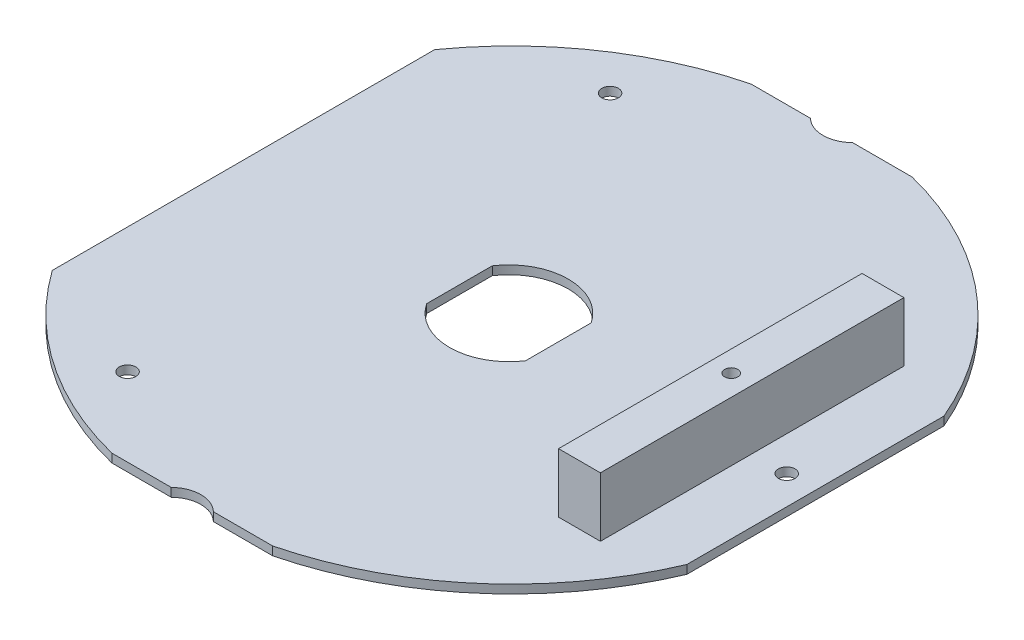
SolidWorks part; units mm, degrees
ref_plane "Front Plane" through (0, 0, 0) normal (0, 0, 1) x (1, 0, 0)
ref_plane "Top Plane" through (0, 0, 0) normal (0, 1, 0) x (1, 0, 0)
ref_plane "Right Plane" through (0, 0, 0) normal (1, 0, 0) x (0, 0, -1)
sketch "Sketch1" plane through (0, 0, 0) normal (0, 1, 0) x (1, 0, 0)
  line L0 (-51.7281, 36.83) -> (-51.7281, 0)
  line L1 (58.4717, 24.765) -> (58.4717, 0)
  line L2 (0, 0) -> (-51.7281, 0) construction
  line L3 (58.4717, 0) -> (0, 0) construction
  line L4 (-27.5746, -46.482) -> (-26.1888, -45.6819) construction
  line L5 (-26.1888, -45.6819) -> (51.5487, -0.8001) construction
  line L6 (51.5487, -0.8001) -> (52.9345, 0) construction
  line L7 (-27.5746, -44.8818) -> (-27.5746, 0) construction
  line L8 (-27.5746, 0) -> (-27.5746, 44.8818) construction
  line L9 (-27.5746, 44.8818) -> (-27.5746, 46.482) construction
  line L10 (-27.5746, 46.482) -> (-26.1888, 45.6819) construction
  line L11 (-26.1888, 45.6819) -> (51.5487, 0.8001) construction
  line L12 (51.5487, 0.8001) -> (52.9345, 0) construction
  line L13 (-27.5746, -44.8818) -> (-27.5746, -46.482) construction
  line L14 (0, 59.9297) -> (0, 65.7571) construction
  line L15 (-51.7281, 0) -> (-51.7281, -36.83)
  line L16 (0, 0) -> (0, 63.5) construction
  line L17 (-4.064, 61.5807) -> (-15.494, 61.5807)
  line L18 (58.4717, 0) -> (58.4717, -24.765)
  line L19 (8.9417, 6.3182) -> (8.9417, -6.3182)
  line L20 (15.494, 61.5807) -> (4.064, 61.5807)
  line L21 (15.494, -61.5807) -> (4.064, -61.5807)
  line L22 (0, -63.5) -> (0, -61.5807) construction
  line L23 (0, 59.9297) -> (0, 63.5) construction
  line L24 (0, -61.5807) -> (0, -59.9297) construction
  line L25 (-4.064, -61.5807) -> (-15.494, -61.5807)
  line L26 (4.064, -61.5807) -> (0, -61.5807) construction
  line L27 (0, -61.5807) -> (-4.064, -61.5807) construction
  line L28 (0, -65.7571) -> (0, -63.5) construction
  line L29 (-10.1083, -6.3182) -> (-10.1083, 6.3182)
  line L30 (-0.5833, 0) -> (-0.5833, -11.43) construction
  line L31 (-10.1083, -6.3182) -> (-0.5833, -6.3182) construction
  line L32 (-0.5833, -6.3182) -> (8.9417, -6.3182) construction
  arc A0 (-51.7281, -36.83) -> (-15.494, -61.5807) centre (0, 0) ccw
  arc A1 (58.4717, 24.765) -> (15.494, 61.5807) centre (0, 0) ccw
  circle A2 centre (-27.5746, -46.482) radius 1.6002
  circle A3 centre (-27.5746, 46.482) radius 1.6002
  circle A4 centre (52.9345, 0) radius 1.6002
  arc A5 (-4.064, 61.5807) -> (4.064, 61.5807) centre (0, 65.7571) ccw
  arc A6 (-10.1083, -6.3182) -> (8.9417, -6.3182) centre (-0.5833, 0) ccw
  arc A7 (-15.494, 61.5807) -> (-51.7281, 36.83) centre (0, 0) ccw
  arc A8 (15.494, -61.5807) -> (58.4717, -24.765) centre (0, 0) ccw
  arc A9 (4.064, -61.5807) -> (-4.064, -61.5807) centre (0, -65.7571) ccw
  arc A10 (8.9417, 6.3182) -> (-10.1083, 6.3182) centre (-0.5833, 0) ccw
  point P14 (-27.5746, 44.8818)
  point P15 (-27.5746, -44.8818)
  point P16 (54.5347, 0)
  point P26 (0, 59.9297)
  point P27 (-4.064, 61.5807)
  point P28 (4.064, 61.5807)
  point P34 (58.4717, 0)
  point P41 (-15.494, -61.5807)
  point P42 (15.494, -61.5807)
  point P43 (15.494, 61.5807)
  point P44 (-15.494, 61.5807)
  point P50 (-4.064, -61.5807)
  point P51 (4.064, -61.5807)
  dimension "D1" = 127
  dimension "D5" = 3.2004
  dimension "D10" = 22.86
  dimension "D2" = 49.53
  dimension "D3" = 73.66
  dimension "D4" = 92.964
  dimension "D6" = 3.937
  dimension "D7" = 92.964
  dimension "D8" = 1.651
  dimension "D9" = 8.128
  dimension "D11" = 19.05
  dimension "D12" = 30.988
  dimension "D13" = 30.988
  dimension "D14" = 1.9193
  dimension "D15" = 8.128
  dimension "D16" = 1.651
  dimension "D17" = 49.53
extrude "Boss-Extrude2" add sketch "Sketch1" along normal blind 1.651 contours A8 L18 L1 A1 L20 A5 L17 A7 L0 L15 A0 L25 A9 L21
sketch "Sketch2" plane through (0, 1.651, 0) normal (0, 1, 0) x (1, 0, 0)
  line L0 (58.4717, -24.765) -> (58.4717, 24.765) construction
  line L1 (38.2152, 29.2354) -> (46.2797, 29.2354)
  line L2 (38.2152, 29.2354) -> (38.2152, -29.2354)
  line L3 (38.2152, -29.2354) -> (46.2797, -29.2354)
  line L4 (46.2797, 29.2354) -> (46.2797, -29.2354)
  line L5 (52.9345, 0) -> (46.2797, 0) construction
  dimension "D1" = 58.4708
  dimension "D2" = 8.0645
  dimension "D3" = 12.192
extrude "Boss-Extrude3" add sketch "Sketch2" along normal blind 11.43 contours L2 L3 L4 L1
sketch "Sketch3" plane through (0, 13.081, 0) normal (0, 1, 0) x (1, 0, 0)
  line L0 (38.2152, 0) -> (42.2475, 0) construction
  line L1 (38.2152, 29.2354) -> (38.2152, -29.2354) construction
  line L2 (42.2475, 0) -> (42.2475, 29.2354) construction
  line L3 (46.2797, 29.2354) -> (38.2152, 29.2354) construction
  circle A0 centre (42.2475, 0) radius 1.27
  dimension "D1" = 2.54
extrude "Cut-Extrude1" cut sketch "Sketch3" against normal blind 2.54
sketch "Sketch4" plane through (0, 1.651, 0) normal (0, 1, 0) x (1, 0, 0)
  line L0 (-27.5746, 46.482) -> (0, 0) construction
  line L1 (0, 0) -> (-27.5746, -46.482) construction
  line L2 (-27.5746, -46.482) -> (52.9345, 0) construction
  line L3 (52.9345, 0) -> (-27.5746, 46.482) construction
  line L4 (-27.5746, 46.482) -> (-27.5746, -46.482) construction
  line L5 (52.9345, 0) -> (0, 0) construction
